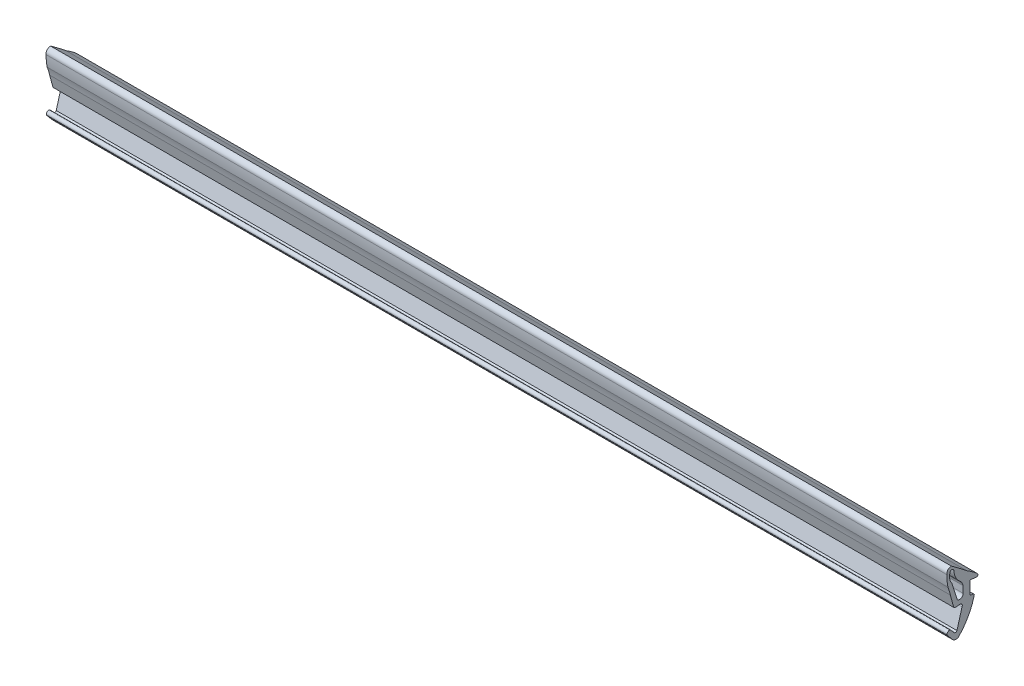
SolidWorks part; units mm, degrees
ref_plane "Front Plane" through (0, 0, 0) normal (0, 0, 1) x (1, 0, 0)
ref_plane "Top Plane" through (0, 0, 0) normal (0, 1, 0) x (1, 0, 0)
ref_plane "Right Plane" through (0, 0, 0) normal (1, 0, 0) x (0, 0, -1)
sketch3d "3DSketch2"
  line L0 (0, 0, 0) -> (200, 0, 0)
  dimension "D1" = 200
other "Paneelitiivisteet 1.6018 PANEELITIIVISTE 30(1)"
ref_plane "Plane1" through (0, 0, 0) normal (1, 0, 0) x (0, 0, -1)
sketch "Sketch14" plane through (0, 0, 0) normal (1, 0, 0) x (0, 0, -1)
  line L0 (-2.7629, 6.6505) -> (-2.7627, 6.6321)
  line L1 (0.1697, 1.207) -> (0.1697, 2.6741)
  line L2 (-2.3213, 4.3941) -> (-1.0903, 0.5525)
  line L3 (-2.6672, 2.2881) -> (-1.9188, -0.4503)
  line L4 (-1.2535, -0.6358) -> (-0.6021, -0.5209)
  line L5 (-0.0779, -1.2557) -> (-1.2044, -5.2584)
  line L6 (-1.8607, -5.3216) -> (-2.5127, -4.5445)
  line L7 (-3.2788, -5.1873) -> (-2.1929, -6.4814)
  line L8 (2.3931, -0.0423) -> (1.9176, 0.0415)
  line L9 (1.6697, 0.3369) -> (1.6697, 2.7866)
  line L10 (1.8871, 2.9859) -> (3.1436, 2.8759)
  line L11 (3.3818, 3.3869) -> (3.1729, 3.5959)
  arc A0 (-2.0101, 6.8441) -> (-2.7629, 6.6505) centre (-2.3629, 6.6556) ccw
  arc A1 (-2.0101, 6.8441) -> (-1.8917, 6.7235) centre (-1.7455, 6.9854) ccw
  arc A2 (-1.8917, 6.7235) -> (-0.6878, 4.011) centre (1.8106, 6.7433) ccw
  arc A3 (0.1697, 2.6741) -> (-0.6878, 4.011) centre (-2.0749, 2.1778) ccw
  arc A4 (-1.0903, 0.5525) -> (0.1697, 1.207) centre (-0.6303, 1.207) ccw
  arc A5 (-2.7627, 6.6321) -> (-2.3213, 4.3941) centre (-0.3481, 5.9458) ccw
  arc A6 (-2.4479, 7.7561) -> (-3.4598, 6.6157) centre (-2.4697, 6.7563) ccw
  arc A7 (-3.4598, 6.6157) -> (-3.2113, 4.0884) centre (10.4844, 6.7111) ccw
  arc A8 (-2.6672, 2.2881) -> (-3.2113, 4.0884) centre (-15.6827, -0.6624) ccw
  arc A9 (-1.9188, -0.4503) -> (-1.2535, -0.6358) centre (-1.3924, 0.152) ccw
  arc A10 (-0.0779, -1.2557) -> (-0.6021, -0.5209) centre (-0.5152, -1.0133) ccw
  arc A11 (-1.8607, -5.3216) -> (-1.2044, -5.2584) centre (-1.5543, -5.0645) ccw
  arc A12 (-2.5127, -4.5445) -> (-3.2788, -5.1873) centre (-2.8958, -4.8659) ccw
  arc A13 (-2.1929, -6.4814) -> (-0.8137, -6.6285) centre (-1.4269, -5.8386) ccw
  arc A14 (-0.8137, -6.6285) -> (2.6196, -0.4493) centre (-10.7489, 2.935) ccw
  arc A15 (2.6196, -0.4493) -> (2.3931, -0.0423) centre (2.3411, -0.3378) ccw
  arc A16 (1.6697, 0.3369) -> (1.9176, 0.0415) centre (1.9697, 0.3369) ccw
  arc A17 (1.8871, 2.9859) -> (1.6697, 2.7866) centre (1.8697, 2.7866) ccw
  arc A18 (3.1436, 2.8759) -> (3.3818, 3.3869) centre (3.1697, 3.1748) ccw
  arc A19 (3.1729, 3.5959) -> (1.0215, 5.1301) centre (-9.4825, -11.8747) ccw
  arc A20 (1.0215, 5.1301) -> (-2.4479, 7.7561) centre (-45.856, -53.1995) ccw
  point P54 (0, 0)
